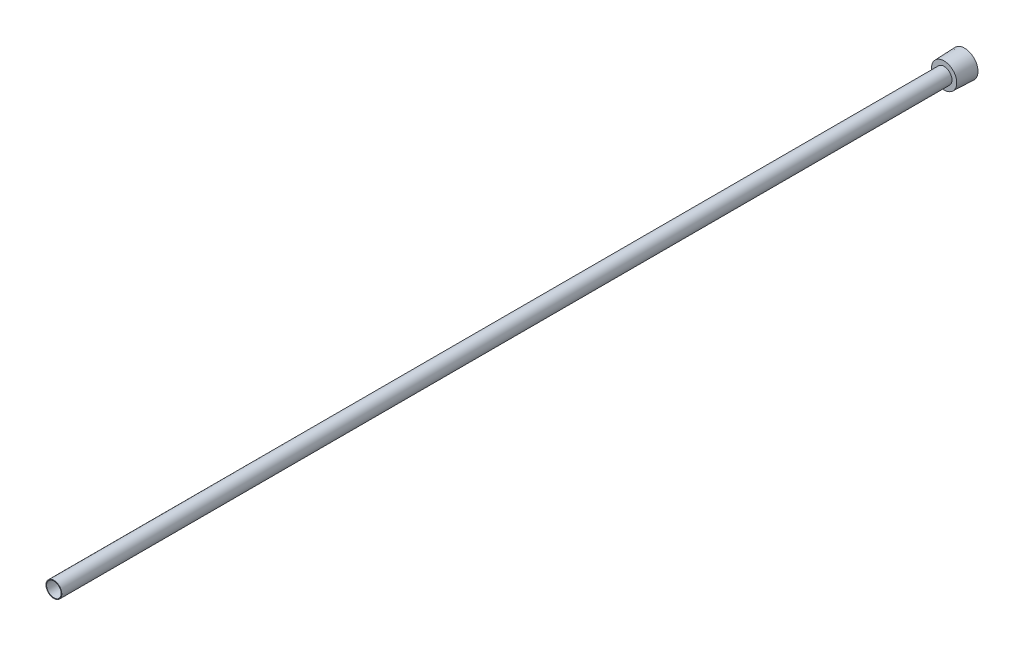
SolidWorks part; units mm, degrees
ref_plane "Front Plane" through (0, 0, 0) normal (0, 0, 1) x (1, 0, 0)
ref_plane "Top Plane" through (0, 0, 0) normal (0, 1, 0) x (1, 0, 0)
ref_plane "Right Plane" through (0, 0, 0) normal (1, 0, 0) x (0, 0, -1)
sketch "Sketch1" plane through (0, 0, 0) normal (1, 0, 0) x (0, 0, -1)
  line L0 (-331.1242, 0) -> (49668.8758, 0) construction
  line L1 (0, 0) -> (-457.2, 0)
  line L6 (0, 0) -> (0, 6.7183)
  line L7 (0, 6.7183) -> (-10.3124, 6.3421)
  line L8 (-10.3124, 3.9688) -> (-457.2, 3.9687)
  line L9 (-10.3124, 6.3421) -> (-10.3124, 3.9688)
  line L10 (-457.2, 3.9687) -> (-457.2, 0)
  dimension "D1" = 7.9375
  dimension "D2" = 10.3124
  dimension "D3" = 2.089
  dimension "D4" = 13.4366
  dimension "D5" = 457.2
revolve "Revolve1" add sketch "Sketch1" angle 360 about L0
sketch "Sketch2" plane through (0, 0, 457.2) normal (0, 0, 1) x (1, 0, 0)
  circle A0 centre (0, 0) radius 3.6512
  dimension "D1" = 7.3025
extrude "Cut-Extrude1" cut sketch "Sketch2" against normal through all
sketch "Sketch3" plane through (0, 0, 0) normal (0, 0, -1) x (-1, 0, 0)
  line L0 (0, 7.3901) -> (0, -7.3901) construction
  line L1 (-4.7625, -2.7496) -> (0, -5.4993)
  line L2 (0, -5.4993) -> (4.7625, -2.7496)
  line L3 (4.7625, -2.7496) -> (4.7625, 2.7496)
  line L4 (4.7625, 2.7496) -> (0, 5.4993)
  line L5 (0, 5.4993) -> (-4.7625, 2.7496)
  line L6 (-4.7625, 2.7496) -> (-4.7625, -2.7496)
  circle A0 centre (0, 0) radius 4.7625 construction
  dimension "D1" = 9.525
extrude "Cut-Extrude2" cut sketch "Sketch3" against normal blind 6.35
